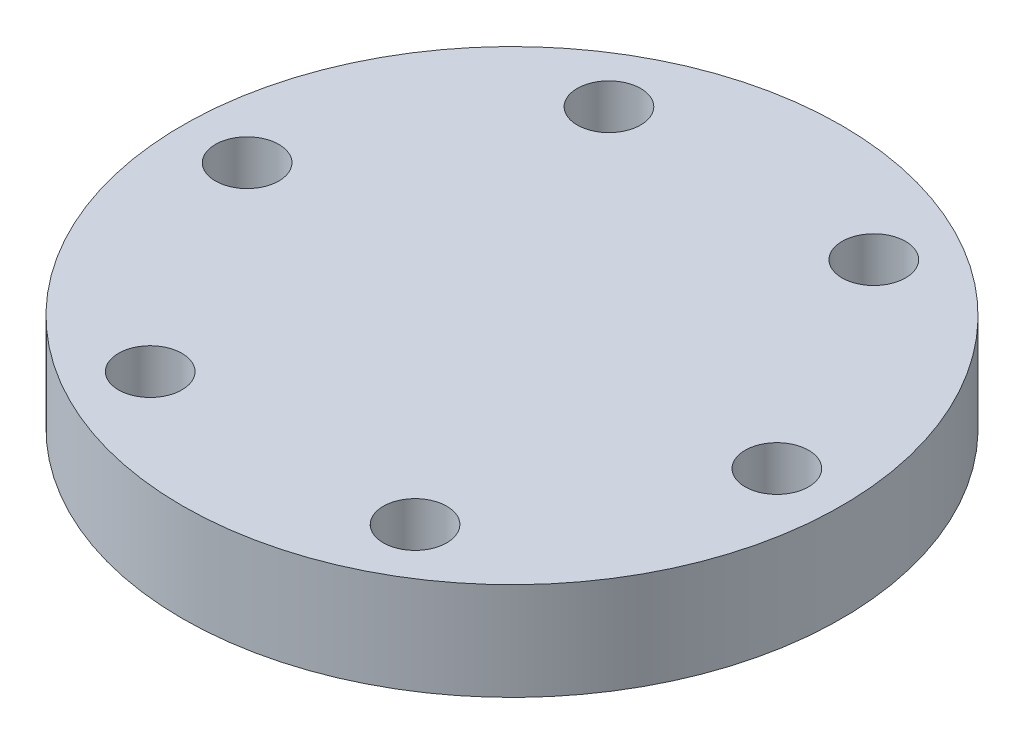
SolidWorks part; units mm, degrees
ref_plane "Front Plane" through (0, 0, 0) normal (0, 0, 1) x (1, 0, 0)
ref_plane "Top Plane" through (0, 0, 0) normal (0, 1, 0) x (1, 0, 0)
ref_plane "Right Plane" through (0, 0, 0) normal (1, 0, 0) x (0, 0, -1)
sketch "Sketch1" plane through (0, 0, 0) normal (0, 1, 0) x (1, 0, 0)
  circle A0 centre (0, 0) radius 27
  dimension "D1" = 54
extrude "Boss-Extrude1" add sketch "Sketch1" along normal blind 8
sketch "Sketch2" plane through (0, 8, 0) normal (0, 1, 0) x (1, 0, 0)
  line L0 (-28.4, 0) -> (-15, 0) construction
  circle A1 centre (0, 0) radius 15 construction
  circle A2 centre (0, 0) radius 28.4 construction
  circle A3 centre (-21.7, 0) radius 2.6
  circle A4 centre (-10.85, 18.7928) radius 2.6
  circle A5 centre (10.85, 18.7928) radius 2.6
  circle A6 centre (21.7, 0) radius 2.6
  circle A7 centre (10.85, -18.7928) radius 2.6
  circle A8 centre (-10.85, -18.7928) radius 2.6
  point P21 (0, 0)
  dimension "D1" = 30
  dimension "D2" = 56.8
  dimension "D3" = 5.2
  dimension "D4" = 6
extrude "Cut-Extrude1" cut sketch "Sketch2" against normal through all
